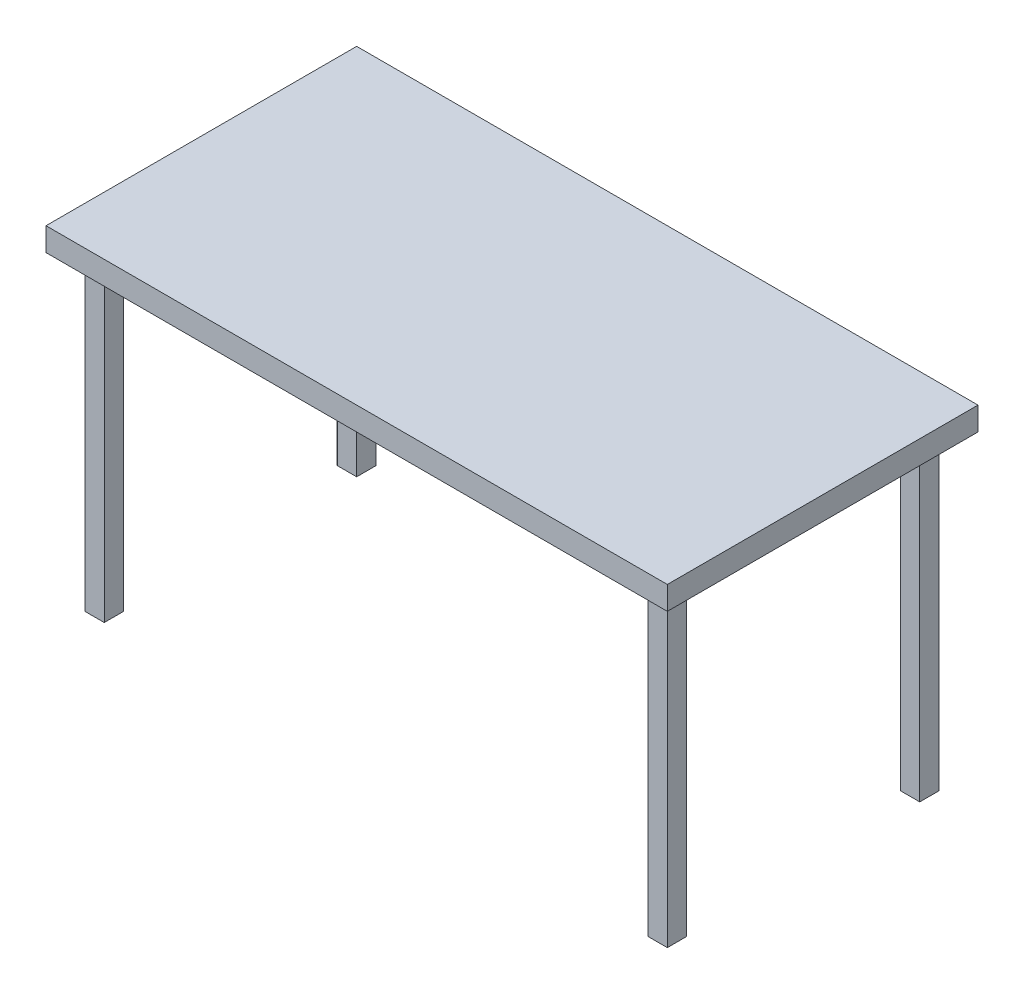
SolidWorks part; units mm, degrees
ref_plane "Plan de face" through (0, 0, 0) normal (0, 0, 1) x (1, 0, 0)
ref_plane "Plan de dessus" through (0, 0, 0) normal (0, 1, 0) x (1, 0, 0)
ref_plane "Plan de droite" through (0, 0, 0) normal (1, 0, 0) x (0, 0, -1)
sketch "Esquisse1" plane through (0, 0, 0) normal (0, 1, 0) x (1, 0, 0)
  line L1 (800, -400) -> (-800, -400)
  line L2 (800, -400) -> (800, 400)
  line L3 (800, 400) -> (-800, 400)
  line L4 (-800, -400) -> (-800, 400)
  line L5 (800, -400) -> (-800, 400) construction
  line L6 (800, 400) -> (-800, -400) construction
  point P0 (0, 0)
  dimension "D1" = 800
  dimension "D2" = 1600
extrude "Boss.-Extru.1" add sketch "Esquisse1" along normal blind 60
sketch "Esquisse2" plane through (0, 0, 0) normal (0, -1, 0) x (1, 0, 0)
  line L0 (-800, 400) -> (800, 400) construction
  line L1 (-750, 350) -> (-700, 350)
  line L2 (-750, 350) -> (-750, 300)
  line L3 (-750, 300) -> (-700, 300)
  line L4 (-700, 350) -> (-700, 300)
  line L5 (-750, 350) -> (-700, 300) construction
  line L6 (-750, 300) -> (-700, 350) construction
  line L7 (-800, -400) -> (-800, 400) construction
  point P0 (-725, 325)
  dimension "D1" = 50
  dimension "D2" = 50
  dimension "D3" = 50
  dimension "D4" = 50
extrude "Boss.-Extru.2" add sketch "Esquisse2" along normal blind 800
mirror "Symétrie1" about plane through (0, 0, 0) normal (1, 0, 0) of "Boss.-Extru.2"
mirror "Symétrie2" about plane through (0, 0, 0) normal (0, 0, 1) of "Symétrie1", "Boss.-Extru.2"
